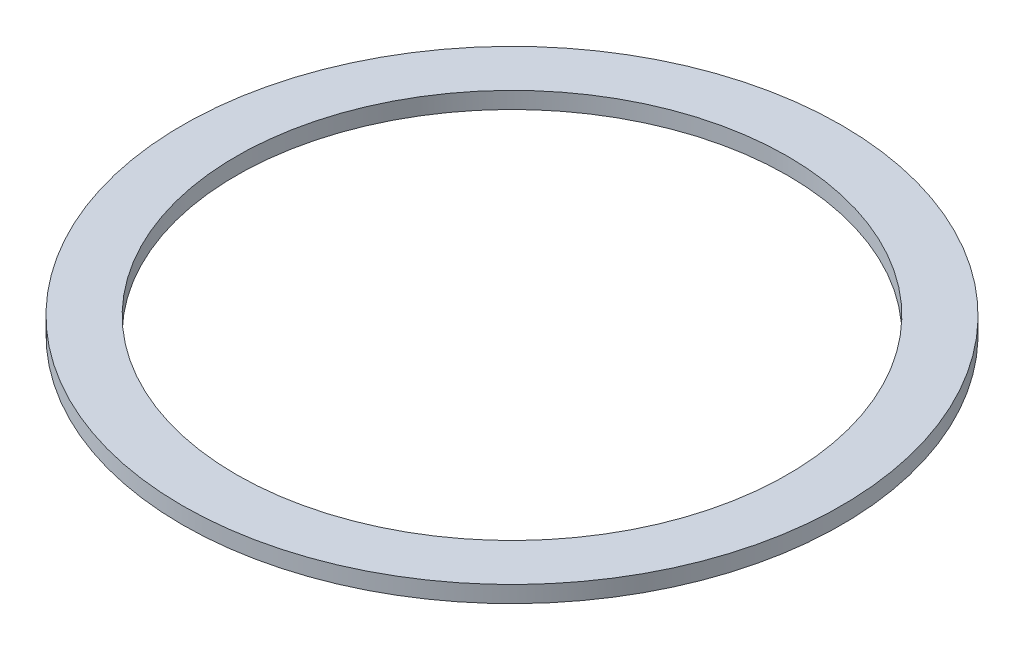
SolidWorks part; units mm, degrees
ref_plane "Front Plane" through (0, 0, 0) normal (0, 0, 1) x (1, 0, 0)
ref_plane "Top Plane" through (0, 0, 0) normal (0, 1, 0) x (1, 0, 0)
ref_plane "Right Plane" through (0, 0, 0) normal (1, 0, 0) x (0, 0, -1)
sketch "Sketch1" plane through (0, 0, 0) normal (0, 0, 1) x (1, 0, 0)
  line L0 (0, -10) -> (0, 1100) construction
  line L1 (133, 0) -> (159, 0)
  line L2 (159, 0) -> (159, 8)
  line L3 (159, 8) -> (133, 8)
  line L4 (133, 8) -> (133, 0)
revolve "Steel Ballast Ring" add sketch "Sketch1" angle 360 about L0
